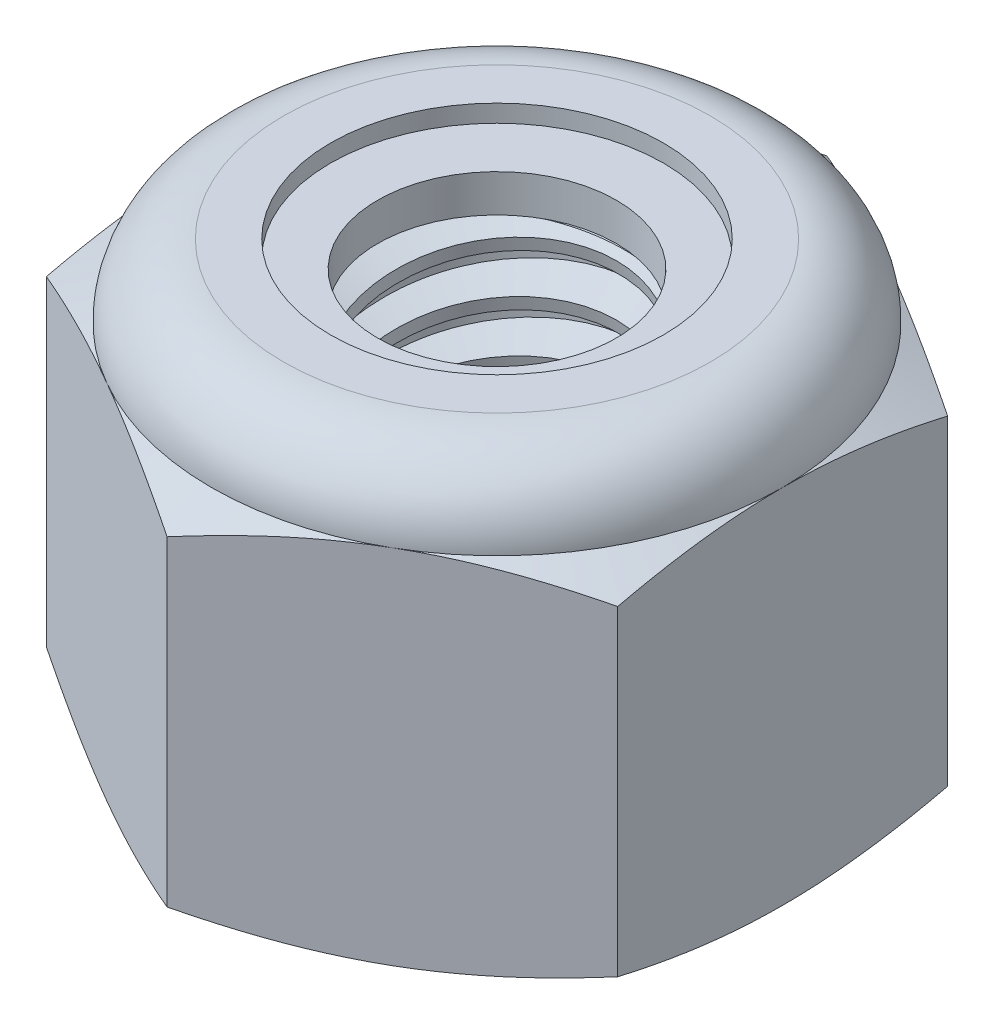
SolidWorks part; units mm, degrees
ref_plane "Front" through (0, 0, 0) normal (0, 0, 1) x (1, 0, 0)
ref_plane "Top" through (0, 0, 0) normal (0, 1, 0) x (1, 0, 0)
ref_plane "Right" through (0, 0, 0) normal (1, 0, 0) x (0, 0, -1)
sketch "Sketch1" plane through (0, 0, 0) normal (0, 1, 0) x (1, 0, 0)
  line L1 (0, 2.8868) -> (-2.5, 1.4434)
  line L2 (-2.5, 1.4434) -> (-2.5, -1.4434)
  line L3 (-2.5, -1.4434) -> (0, -2.8868)
  line L4 (0, -2.8868) -> (2.5, -1.4434)
  line L5 (2.5, -1.4434) -> (2.5, 1.4434)
  line L6 (2.5, 1.4434) -> (0, 2.8868)
  circle A0 centre (0, 0) radius 2.5 construction
  dimension "Hex Flats" = 5
extrude "Extrude1" add sketch "Sketch1" along normal blind 3.8
sketch "Sketch2" plane through (0, 0, 0) normal (1, 0, 0) x (0, 0, -1)
  line L0 (-1.25, 0) -> (-1.25, 3.8) construction
  line L1 (0, 0) -> (1.25, 0)
  line L2 (0, 0) -> (0, 3.8)
  line L3 (0, 3.8) -> (1.25, 3.8)
  line L4 (1.25, 0) -> (1.25, 3.8)
  line L5 (-1.4434, 3.8) -> (1.4434, 3.8) construction
  line L7 (0, -1.25) -> (0, 0) construction
  dimension "Thread Dia" = 2.5
revolve "Revolve1" add sketch "Sketch2" angle 360 about L7
sketch "Sketch3" plane through (0, 0, 0) normal (1, 0, 0) x (0, 0, -1)
  line L0 (1.25, 3.8) -> (-1.25, 3.8) construction
  line L1 (-1.25, 3.8) -> (-1.25, 3.35) construction
  line L2 (-1.25, 3.35) -> (1.25, 3.8) construction
  line L3 (1.25, 3.8) -> (1.26, 3.7446) construction
  line L4 (1.26, 3.7446) -> (1.3297, 3.3571)
  line L5 (1.3297, 3.3571) -> (1.0651, 3.4524)
  line L6 (1.0651, 3.4524) -> (1.0452, 3.5631)
  line L7 (1.0452, 3.5631) -> (1.26, 3.7446)
  line L8 (1.0551, 3.5077) -> (1.2948, 3.5509) construction
  line L9 (1.25, 3.8) -> (1.25, 3.5428) construction
  line L10 (1.25, 3.5428) -> (-1.25, 3.0928) construction
  line L11 (-1.25, 3.0928) -> (-1.25, 3.35) construction
  line L12 (-0.0868, 3.8) -> (0.0868, 2.8356) construction
  line L13 (-1.25, 0) -> (-1.25, 3.8) construction
  line L14 (0, 3.8) -> (1.25, 3.8) construction
  line L15 (1.25, 0) -> (1.25, 3.8) construction
  point P13 (0, 3.3178)
revolve "Cut-Revolve1" cut sketch "Sketch3" angle 360 about L12
pattern_linear "LPattern1" count 8 spacing 0.45 along (0, -1, 0) count 2 spacing 0.45 along (0, 1, 0) of "Cut-Revolve1"
sketch "Sketch4" plane through (0, 0, 0) normal (1, 0, 0) x (0, 0, -1)
  line L0 (0, 3.8) -> (1.25, 3.8)
  line L1 (1.25, 3.8) -> (1.0452, 3.7045)
  line L2 (1.0452, 3.7045) -> (1.0452, 0.0955)
  line L3 (1.0452, 0.0955) -> (1.25, 0)
  line L4 (1.25, 0) -> (0, 0)
  line L5 (0, 0) -> (0, 3.8)
  line L6 (1.25, 0) -> (1.25, 3.8) construction
  line L7 (0, 3.8) -> (1.25, 3.8) construction
  line L8 (0, 0) -> (1.25, 0) construction
  line L9 (0, 0) -> (0, 3.8) construction
  line L10 (0, 3.8) -> (0, 4.026) construction
  dimension "D1" = 25
revolve "Cut-Revolve2" cut sketch "Sketch4" angle 360 about L10
combine bodies "Combine1" operation type subtract main body 112 bodies to subtract 111
sketch "Sketch5" plane through (0, 0, 0) normal (1, 0, 0) x (0, 0, -1)
  line L0 (0, 0) -> (2.5, 0)
  line L1 (2.5, 0) -> (2.8868, 0.1803)
  line L2 (2.8868, 0.1803) -> (2.8868, 2.9863)
  line L3 (2.8868, 2.9863) -> (2.5, 3.1667)
  line L4 (1.8667, 3.8) -> (1.8667, 5.07)
  line L5 (1.8667, 5.07) -> (4.1568, 5.07)
  line L6 (4.1568, 5.07) -> (4.1568, -1.27)
  line L7 (4.1568, -1.27) -> (0, -1.27)
  line L8 (0, -1.27) -> (0, 0)
  line L9 (2.5, 3.1667) -> (2.5, 0) construction
  line L10 (0, 0) -> (1.25, 0) construction
  line L13 (2.8868, 1.5833) -> (4.1568, 1.5833) construction
  line L14 (2.8868, 3.8) -> (2.8868, 0) construction
  line L15 (0, 0) -> (0, 5.07) construction
  line L20 (0, 5.07) -> (1.8667, 5.07) construction
  line L22 (0, 3.8) -> (1.25, 3.8) construction
  arc A0 (2.5, 3.1667) -> (1.8667, 3.8) centre (1.8667, 3.1667) ccw
revolve "Cut-Revolve3" cut sketch "Sketch5" angle 360 about L15
sketch "Sketch6" plane through (0, 0, 0) normal (1, 0, 0) x (0, 0, -1)
  line L0 (0, 3.1667) -> (2.3476, 3.1667)
  line L1 (1.8667, 3.6476) -> (1.4559, 3.6476)
  line L2 (0, 5.07) -> (0, 3.1667)
  line L3 (1.4559, 5.07) -> (0, 5.07)
  line L4 (0, 5.07) -> (1.8667, 5.07) construction
  line L5 (0, 0) -> (0, 5.07) construction
  line L6 (0, 5.07) -> (0, 44.323) construction
  line L7 (1.4559, 3.6476) -> (1.4559, 5.07)
  line L8 (1.8667, 3.8) -> (1.8667, 3.6476) construction
  line L9 (1.4559, 3.6476) -> (1.0452, 3.6476) construction
  line L10 (1.0452, 3.6476) -> (1.0452, 3.7045) construction
  arc A0 (2.3476, 3.1667) -> (1.8667, 3.6476) centre (1.8667, 3.1667) ccw
  arc A1 (2.5, 3.1667) -> (1.8667, 3.8) centre (1.8667, 3.1667) ccw construction
  dimension "D1" = 0.1524
revolve "Cut-Revolve4" cut sketch "Sketch6" angle 360 about L6
sketch "Sketch7" plane through (0, 0, 0) normal (1, 0, 0) x (0, 0, -1)
  line L0 (1.0452, 3.2429) -> (2.2642, 3.2429)
  line L1 (1.8667, 3.5714) -> (1.0452, 3.5714)
  line L2 (1.0452, 3.5714) -> (1.0452, 3.2429)
  line L3 (1.0452, 3.2429) -> (0, 3.2429) construction
  line L4 (0, 3.2429) -> (0, 3.5714) construction
  line L5 (0, 3.5714) -> (1.0452, 3.5714) construction
  line L6 (1.0452, 3.2429) -> (1.0452, 3.1667) construction
  line L7 (0, 3.1667) -> (2.3476, 3.1667) construction
  line L8 (1.8667, 3.5714) -> (1.8667, 3.6476) construction
  arc A0 (2.2642, 3.2429) -> (1.8667, 3.5714) centre (1.8667, 3.1667) ccw
  arc A2 (2.3476, 3.1667) -> (1.8667, 3.6476) centre (1.8667, 3.1667) ccw construction
  dimension "D1" = 0.0762
revolve "Revolve2" add sketch "Sketch7" angle 360 about L4
equation "\"D1@Sketch3\"=\"Thread Pitch@Sketch3\"/8"
equation "\"D2@Sketch3\"=\"Thread Pitch@Sketch3\"/4"
equation "\"D5@Sketch3\"=\"Thread Pitch@Sketch3\""
equation "\"D4@LPattern1\"=\"Thread Pitch@Sketch3\""
equation "\"D3@LPattern1\"=\"Thread Pitch@Sketch3\""
equation "\"D1@LPattern1\"=\"Height@Extrude1\"/\"Thread Pitch@Sketch3\""
equation "\"D4@Sketch5\"=\"Height@Extrude1\"/6"
